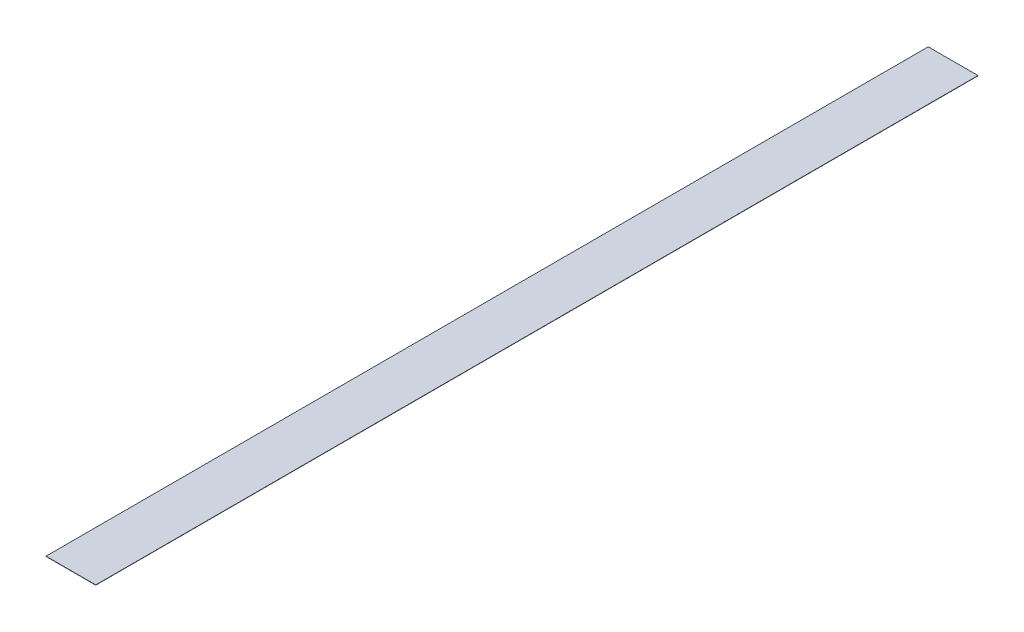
SolidWorks part; units mm, degrees
ref_plane "Front Plane" through (0, 0, 0) normal (0, 0, 1) x (1, 0, 0)
ref_plane "Top Plane" through (0, 0, 0) normal (0, 1, 0) x (1, 0, 0)
ref_plane "Right Plane" through (0, 0, 0) normal (1, 0, 0) x (0, 0, -1)
sketch "Sketch1" plane through (0, 0, 0) normal (0, 1, 0) x (1, 0, 0)
  line L0 (-55, 0) -> (55, 0) construction
  line L1 (0, -55) -> (0, 55) construction
  line L5 (23.8125, -422.275) -> (-23.8125, -422.275)
  line L6 (23.8125, -422.275) -> (23.8125, 422.275)
  line L7 (23.8125, 422.275) -> (-23.8125, 422.275)
  line L8 (-23.8125, -422.275) -> (-23.8125, 422.275)
  point P2 (23.8125, 0)
  point P9 (0, -422.275)
  dimension "D1" = 844.55
  dimension "D2" = 47.625
extrude "Boss-Extrude1" add sketch "Sketch1" along normal blind 0.254
